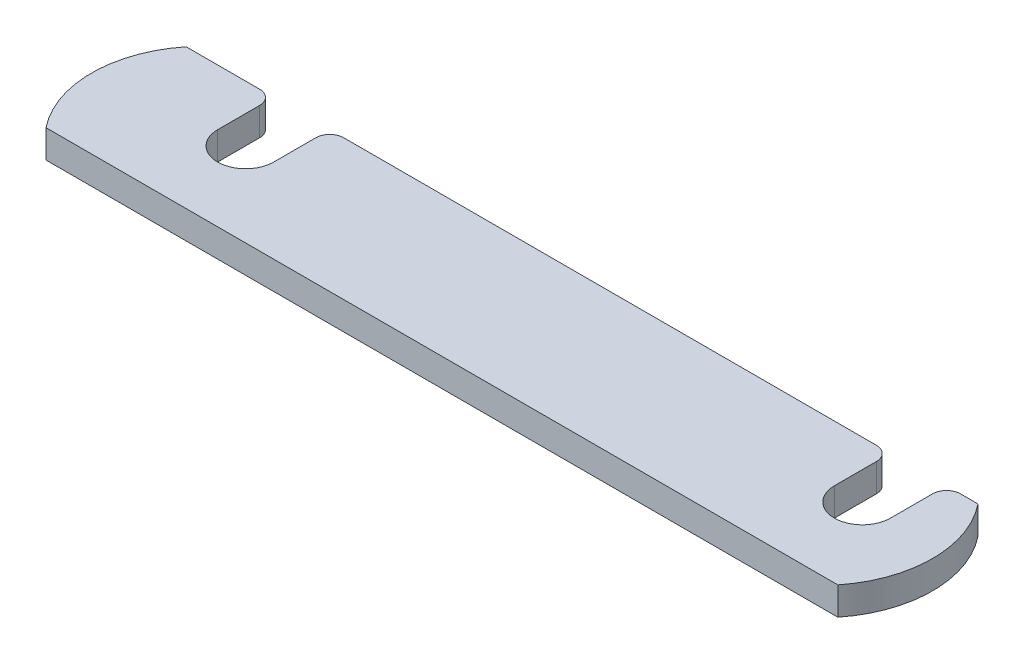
SolidWorks part; units mm, degrees
ref_plane "Plano frontal" through (0, 0, 0) normal (0, 0, 1) x (1, 0, 0)
ref_plane "Plano superior" through (0, 0, 0) normal (0, 1, 0) x (1, 0, 0)
ref_plane "Plano direito" through (0, 0, 0) normal (1, 0, 0) x (0, 0, -1)
sketch "Esboço1" plane through (0, 0, 0) normal (0, 1, 0) x (1, 0, 0)
  line L0 (0, 0) -> (0, 8.973) construction
  line L1 (-28.245, 5) -> (-23, 5)
  line L2 (-17, 5) -> (21, 5)
  line L3 (-28.245, -5) -> (28.245, -5)
  line L4 (27, 5) -> (28.245, 5)
  line L5 (-30, 5) -> (30, -5) construction
  line L6 (-28.4441, -4.7407) -> (30, 5) construction
  line L7 (-20, 5) -> (-20, 1) construction
  line L8 (-18, 4) -> (-18, 1)
  line L9 (-22, 4) -> (-22, 1)
  line L10 (24, 5) -> (24, 1) construction
  line L11 (26, 4) -> (26, 1)
  line L12 (22, 4) -> (22, 1)
  arc A0 (-28.245, 5) -> (-28.245, -5) centre (-22, 0) ccw
  arc A1 (28.245, 5) -> (28.245, -5) centre (22, 0) cw
  arc A2 (26, 4) -> (27, 5) centre (27, 4) cw
  arc A3 (-22, 1) -> (-18, 1) centre (-20, 1) ccw
  arc A4 (22, 4) -> (21, 5) centre (21, 4) ccw
  arc A5 (22, 1) -> (26, 1) centre (24, 1) ccw
  arc A6 (-18, 4) -> (-17, 5) centre (-17, 4) cw
  arc A7 (-22, 4) -> (-23, 5) centre (-23, 4) ccw
  point P0 (0, 0)
  point P16 (-20, 3)
  point P23 (24, 3)
  dimension "D3" = 8
  dimension "D2" = 1
  dimension "D1" = 10
  dimension "D4" = 4
  dimension "D5" = 6
  dimension "D6" = 4
  dimension "D7" = 6
  dimension "D8" = 40
  dimension "D9" = 20
extrude "Ressalto-extrusão2" add sketch "Esboço1" along normal blind 2
